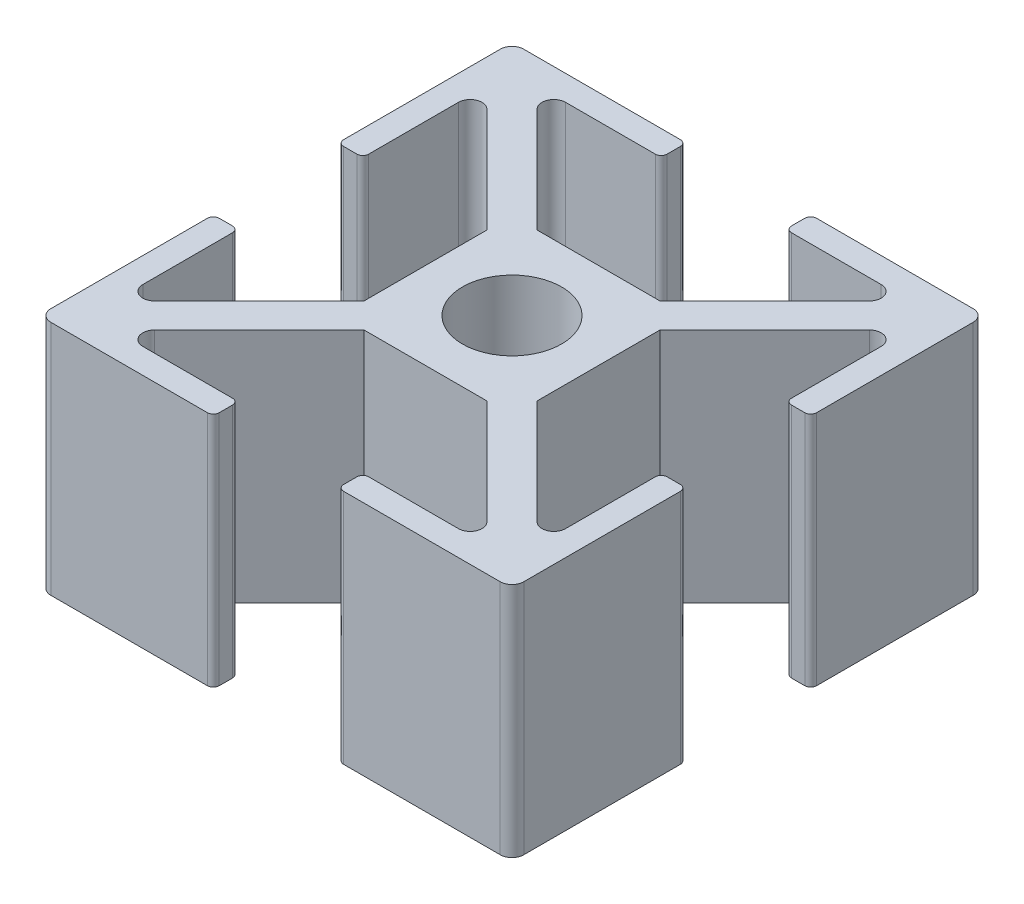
SolidWorks part; units mm, degrees
ref_plane "Front Plane" through (0, 0, 0) normal (0, 0, 1) x (1, 0, 0)
ref_plane "Top Plane" through (0, 0, 0) normal (0, 1, 0) x (1, 0, 0)
ref_plane "Right Plane" through (0, 0, 0) normal (1, 0, 0) x (0, 0, -1)
sketch "Sketch2" plane through (0, 0, 0) normal (0, 1, 0) x (1, 0, 0)
  line L12 (-10, -8.9393) -> (8.9393, 10)
  line L13 (-3.66, -3.66) -> (3.66, -3.66)
  line L26 (-3.66, -3.66) -> (-3.66, 3.66)
  line L27 (-3.66, 3.66) -> (3.66, 3.66)
  line L32 (3.66, -3.66) -> (3.66, 3.66)
  line L37 (-3.66, -3.66) -> (3.66, 3.66) construction
  line L50 (-3.66, 3.66) -> (3.66, -3.66) construction
  line L51 (-10, -8.9393) -> (-8.9393, -10)
  line L52 (8.9393, 10) -> (10, 8.9393)
  line L53 (-8.9393, -10) -> (10, 8.9393)
  line L54 (-10, -8.9393) -> (10, 8.9393) construction
  line L55 (8.9393, 10) -> (-8.9393, -10) construction
  line L56 (0, 0) -> (0, 25.4805) construction
  line L57 (10, 8.9393) -> (2.63, 8.9393)
  line L58 (-10, -8.9393) -> (-10, -10)
  line L59 (-10, -10) -> (-8.9393, -10)
  line L60 (10, 8.9393) -> (10, 10)
  line L61 (10, 10) -> (2.63, 10)
  line L62 (2.63, 8.9393) -> (2.63, 10)
  line L63 (5.995, 7.0557) -> (5.995, 8.9393)
  line L64 (10, 10) -> (10, 2.63)
  line L65 (8.9393, 10) -> (10, 10)
  line L66 (8.9393, 2.63) -> (10, 2.63)
  line L67 (8.9393, 10) -> (8.9393, 2.63)
  circle A0 centre (0, 0) radius 2.095
  point P0 (0, 0)
  dimension "D3" = 4.19
  dimension "D1" = 7.32
  dimension "D2" = 7.32
  dimension "D4" = 20
  dimension "D5" = 1.5
  dimension "D6" = 2.63
  dimension "D8" = 5.995
  dimension "D7" = 90
extrude "Boss-Extrude1" add sketch "Sketch2" along normal blind 10 contours L53 L67 L66 L64 | L67 L57 L12 L27 L32 L53 | L67 L12 L57 | L52 L67 L57 | L60 L61 L52 | L57 L67 L53 | L62 L57 L12 L61 | A0 L53 L32 L27 L12 | A0 L53 L13 L32 | A0 L12 L27 L26 | A0 L12 L26 L13 L53
fillet "Fillet1" radius 0.5 3 edges at (7.8787, 5, -8.9393) (8.9393, 5, -7.8787) (10, 5, -10)
fillet "Fillet2" radius 0.25 4 edges at (2.63, 5, -10) (2.63, 5, -8.9393) (8.9393, 5, -2.63) (10, 5, -2.63)
pattern_circular "CirPattern1" count 4 over 360 about axis through (0, 0, 0) along (0, 1, 0) of "Boss-Extrude1", "Fillet2", "Fillet1"
